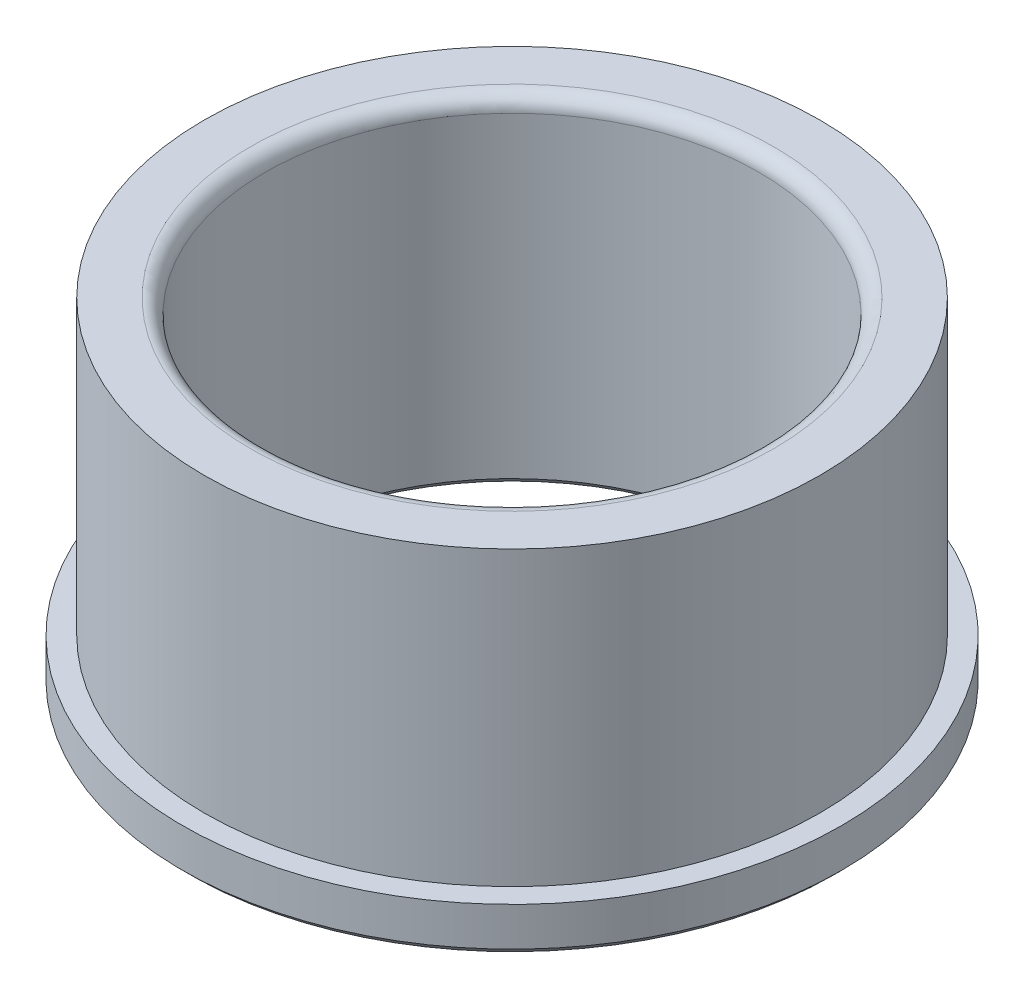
SolidWorks part; units mm, degrees
ref_plane "Front Plane" through (0, 0, 0) normal (0, 0, 1) x (1, 0, 0)
ref_plane "Top Plane" through (0, 0, 0) normal (0, 1, 0) x (1, 0, 0)
ref_plane "Right Plane" through (0, 0, 0) normal (1, 0, 0) x (0, 0, -1)
sketch "Sketch1" plane through (0, 0, 0) normal (0, 0, 1) x (1, 0, 0)
  line L0 (-33.2359, 0) -> (-33.9979, 0.762)
  line L1 (0, -1000) -> (0, 49000) construction
  line L2 (-25.4635, 34.925) -> (-25.4635, 0.762)
  line L3 (-26.2255, 0) -> (-33.2359, 0)
  line L4 (-33.9979, 0.762) -> (-33.9979, 4.7625)
  line L5 (-33.9979, 4.7625) -> (-31.7563, 4.7625)
  line L6 (-31.7563, 34.925) -> (-31.7563, 4.7625)
  line L7 (-31.7563, 34.925) -> (-25.4635, 34.925)
  line L8 (-26.2255, 0) -> (-25.4635, 0.762)
  dimension "OD" = 63.5127
  dimension "ID" = 50.927
  dimension "H" = 67.9958
  dimension "D2" = 45
  dimension "OVERALL LENGTH" = 34.925
  dimension "D4" = 0.762
  dimension "D5" = 135
  dimension "T" = 4.7625
revolve "Revolve1" add sketch "Sketch1" angle 360 about L1
fillet "Fillet1" radius 1.524 1 edges at (25.4635, 34.925, 0)
